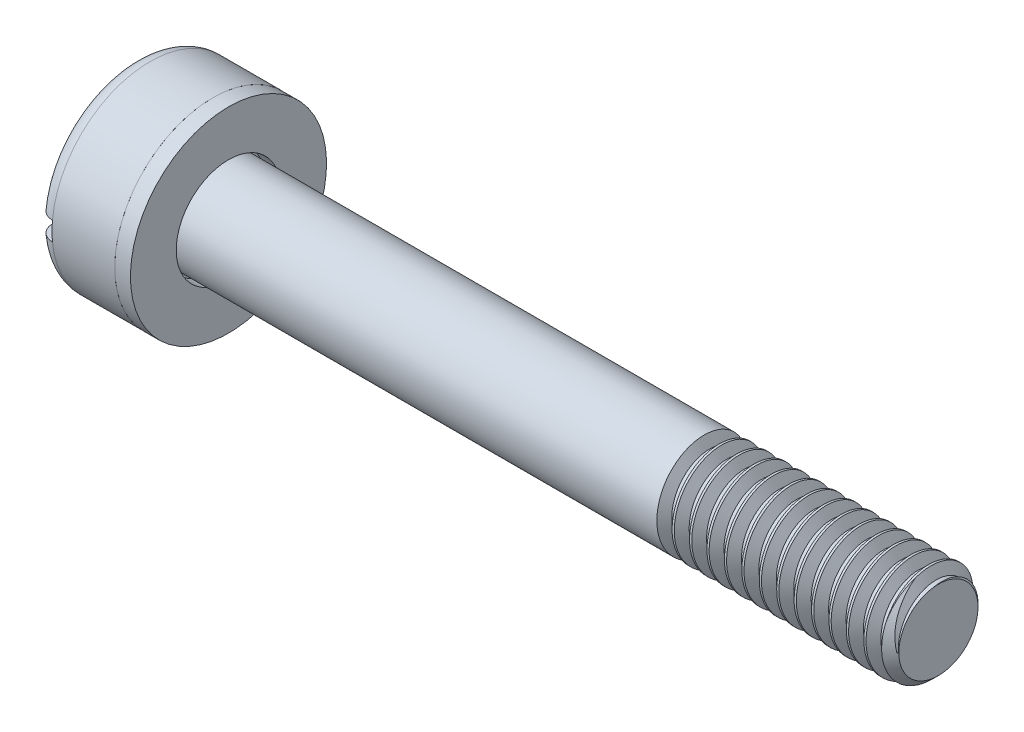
SolidWorks part; units mm, degrees
ref_plane "Front Plane" through (0, 0, 0) normal (0, 0, 1) x (1, 0, 0)
ref_plane "Top Plane" through (0, 0, 0) normal (0, 1, 0) x (1, 0, 0)
ref_plane "Right Plane" through (0, 0, 0) normal (1, 0, 0) x (0, 0, -1)
sketch "Sketch1" plane through (0, 0, 0) normal (0, 0, 1) x (1, 0, 0)
  line L0 (-6.35, 0) -> (58.7375, 0)
  line L1 (0, 0) -> (0, 15.875) construction
  line L2 (0, 0) -> (63.5, 0) construction
  line L3 (58.7375, 0) -> (58.7375, 3.2067)
  line L4 (57.9755, 3.9688) -> (0, 3.9687)
  line L5 (0, 3.9687) -> (0, 7.9375)
  line L6 (0, 7.9375) -> (-5.08, 7.9375)
  line L7 (-6.35, 6.6675) -> (-6.35, 0)
  line L8 (58.7375, 3.2067) -> (57.9755, 3.9688)
  arc A0 (-5.08, 7.9375) -> (-6.35, 6.6675) centre (-5.08, 6.6675) ccw
  point P7 (58.7375, 3.9688)
  point P12 (-6.35, 7.9375)
  dimension "D6" = 1.27
  dimension "D1" = 63.5
  dimension "D2" = 58.7375
  dimension "D3" = 7.9375
  dimension "D4" = 15.875
  dimension "D5" = 6.35
revolve "Revolve1" add sketch "Sketch1" angle 360 about L0
sketch "Sketch2" plane through (-6.35, 0, 0) normal (-1, 0, 0) x (0, 0, 1)
  line L1 (-10.2318, -0.762) -> (10.2318, -0.762)
  line L2 (-10.2318, -0.762) -> (-10.2318, 0.762)
  line L3 (-10.2318, 0.762) -> (10.2318, 0.762)
  line L4 (10.2318, -0.762) -> (10.2318, 0.762)
  line L5 (-10.2318, -0.762) -> (10.2318, 0.762) construction
  line L6 (-10.2318, 0.762) -> (10.2318, -0.762) construction
  point P0 (0, 0)
  dimension "D1" = 1.524
extrude "Cut-Extrude1" cut sketch "Sketch2" against normal blind 1.27
thread "Thread1" pitch 1.4111 start angle 0, offset 1.524, length 19.05, pitch 1.4111, diameter 7.9375
ref_plane "Plane1" through (59.4995, 0, 3.9687) normal (0, -1, 0) x (0, 0, 1)
sketch "Thread Profile1" plane through (59.4995, 0, 3.9687) normal (0, -1, 0) x (0, 0, 1)
  line L0 (0, 0) -> (0, 1.4111) construction
  line L11 (0, 0) -> (0, 1.2347)
  line L12 (0, 1.2347) -> (-0.7638, 0.7937)
  line L13 (-0.7638, 0.7937) -> (-0.7638, 0.441)
  line L15 (-0.7638, 0.441) -> (0, 0)
  line L17 (-0.7638, 0.6174) -> (0, 0.6174) construction
  point P2 (0, 0)
  dimension "Pitch" = 1.4111
  dimension "Profile_Angle" = 60
  dimension "Profile_Land" = 0.3528
  dimension "Profile_Height" = 0.7638
sketch "Sketch5" plane through (0, 0, 0) normal (1, 0, 0) x (0, 0, -1)
  circle A0 centre (0, 0) radius 4.2305
  circle A1 centre (0, 0) radius 7.9375
  dimension "D1" = 15.875
extrude "Boss-Extrude1" add sketch "Sketch5" along normal blind 1.27 separate body
